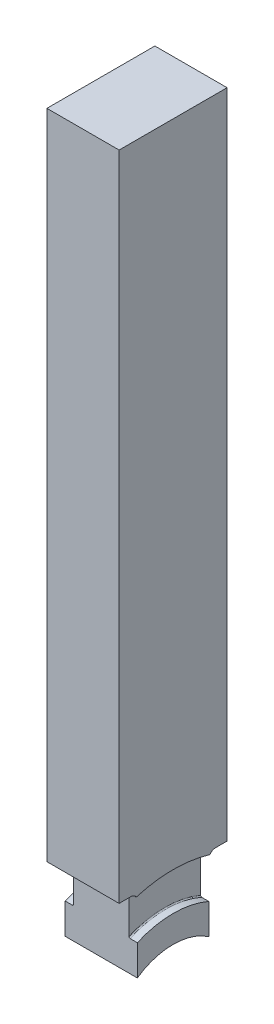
SolidWorks part; units mm, degrees
ref_plane "Front Plane" through (0, 0, 0) normal (0, 0, 1) x (1, 0, 0)
ref_plane "Top Plane" through (0, 0, 0) normal (0, 1, 0) x (1, 0, 0)
ref_plane "Right Plane" through (0, 0, 0) normal (1, 0, 0) x (0, 0, -1)
sketch "Sketch1" plane through (0, 0, 0) normal (1, 0, 0) x (0, 0, -1)
  line L0 (-19.177, 276.225) -> (-19.177, 0)
  line L1 (0, 249.2329) -> (0, 0) construction
  line L2 (19.177, 276.225) -> (19.177, 0)
  line L3 (-19.177, 276.225) -> (19.177, 276.225)
  line L6 (-19.177, 0) -> (19.177, 0)
  arc A0 (-22.225, 0) -> (22.225, 0) centre (0, 0) cw construction
  dimension "R" = 22.225
  dimension "L" = 254
  dimension "T" = 38.354
extrude "Boss-Extrude1" add sketch "Sketch1" along normal mid plane 25.654
sketch "Sketch8" plane through (0, 0, 0) normal (1, 0, 0) x (0, 0, -1)
  circle A0 centre (0, 0) radius 22.225
  arc A1 (22.225, 0) -> (-22.225, 0) centre (0, 0) ccw construction
extrude "Cut-Extrude4" cut sketch "Sketch8" against normal through all both and the other way through all
sketch "Sketch2" plane through (0, 0, 0) normal (0, 0, 1) x (1, 0, 0)
  line L0 (12.827, 31.75) -> (9.8552, 31.75)
  line L1 (12.827, 276.225) -> (12.827, 11.2336) construction
  line L2 (9.8552, 31.75) -> (9.8552, 45.2374)
  line L3 (9.8552, 45.2374) -> (12.827, 45.2374)
  line L4 (12.827, 45.2374) -> (12.827, 31.75)
  line L5 (0, 29.9173) -> (0, 0) construction
  line L6 (-12.827, 45.2374) -> (-12.827, 31.75)
  line L7 (-9.8552, 45.2374) -> (-12.827, 45.2374)
  line L8 (-9.8552, 31.75) -> (-9.8552, 45.2374)
  line L9 (-12.827, 31.75) -> (-9.8552, 31.75)
  line L10 (-8.8482, 0) -> (24.5305, 0) construction
  dimension "D1" = 19.7104
  dimension "D2" = 45.2374
  dimension "D3" = 31.75
revolve "Cut-Revolve1" cut sketch "Sketch2" angle 360 about L10
sketch "Sketch6" plane through (0, 0, 0) normal (1, 0, 0) x (0, 0, -1)
  line L0 (0, 19.903) -> (0, 0) construction
  line L1 (12.7, 0) -> (31.75, 0)
  line L2 (12.7, 0) -> (12.7, 42.037)
  line L3 (15.0876, 44.4246) -> (31.75, 44.4246)
  line L4 (31.75, 0) -> (31.75, 44.4246)
  line L9 (-12.7, 0) -> (-31.75, 0)
  line L10 (-31.75, 0) -> (-31.75, 44.4246)
  line L11 (-15.0876, 44.4246) -> (-31.75, 44.4246)
  line L12 (-12.7, 0) -> (-12.7, 42.037)
  arc A0 (12.7, 42.037) -> (15.0876, 44.4246) centre (15.0876, 42.037) cw
  arc A1 (-12.7, 42.037) -> (-15.0876, 44.4246) centre (-15.0876, 42.037) ccw
  arc A4 (19.177, 11.2336) -> (-19.177, 11.2336) centre (0, 0) ccw construction
  dimension "D3" = 2.3876
  dimension "MT" = 25.4
  dimension "D2" = 19.05
  dimension "D4" = 19.812
extrude "Cut-Extrude2" cut sketch "Sketch6" against normal through all both and the other way through all
fillet "Fillet1" radius 0.762 2 edges at (-9.8552, 45.2374, 0) (9.8552, 45.2374, 0)
fillet "Fillet2" radius 0.381 2 edges at (-9.8552, 31.75, 0) (9.8552, 31.75, 0)
